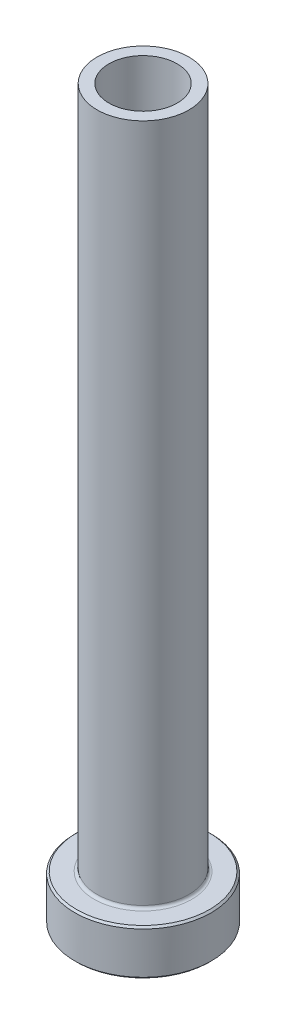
SolidWorks part; units mm, degrees
ref_plane "Front Plane" through (0, 0, 0) normal (0, 0, 1) x (1, 0, 0)
ref_plane "Top Plane" through (0, 0, 0) normal (0, 1, 0) x (1, 0, 0)
ref_plane "Right Plane" through (0, 0, 0) normal (1, 0, 0) x (0, 0, -1)
sketch "Sketch1" plane through (0, 0, 0) normal (0, 0, 1) x (1, 0, 0)
  line L0 (0, 0) -> (0, 50000) construction
  line L1 (0, 0) -> (9.525, 0)
  line L2 (9.525, 0) -> (9.525, 6.35)
  line L3 (9.525, 6.35) -> (6.804, 6.35)
  line L4 (6.4072, 6.7469) -> (6.4072, 101.6)
  line L5 (6.4072, 101.6) -> (0, 101.6)
  line L6 (0, 101.6) -> (0, 0)
  arc A0 (6.4072, 6.7469) -> (6.804, 6.35) centre (6.804, 6.7469) ccw
  dimension "D5" = 0.3969
  dimension "D1" = 12.8143
  dimension "D2" = 19.05
  dimension "D3" = 6.35
  dimension "D4" = 101.6
revolve "Revolve1" add sketch "Sketch1" angle 360 about L0
sketch "Sketch2" plane through (0, 0, 0) normal (0, 0, 1) x (1, 0, 0)
  line L0 (0, 0) -> (0, 50000) construction
  line L1 (-9.525, 0) -> (9.525, 0) construction
  line L2 (5.3499, 0) -> (4.953, 0.3969)
  line L3 (4.953, 0.3969) -> (4.953, 27.1145)
  line L4 (4.953, 27.1145) -> (4.7625, 41.402)
  line L5 (4.7625, 41.402) -> (4.7625, 101.6)
  line L6 (6.4072, 101.6) -> (-6.4072, 101.6) construction
  line L7 (4.7625, 101.6) -> (0, 101.6)
  line L8 (0, 101.6) -> (0, 0)
  line L9 (0, 0) -> (5.3499, 0)
  point P4 (0, 0)
  dimension "D1" = 0.3969
  dimension "D2" = 45
  dimension "D3" = 9.525
  dimension "D4" = 9.906
  dimension "D5" = 60.198
  dimension "D6" = 14.2875
revolve "Cut-Revolve1" cut sketch "Sketch2" angle 360 about L0
chamfer "Chamfer1" distance 0.254 angle 45 2 edges at (0, 0, -9.525) (0, 6.35, -9.525)
